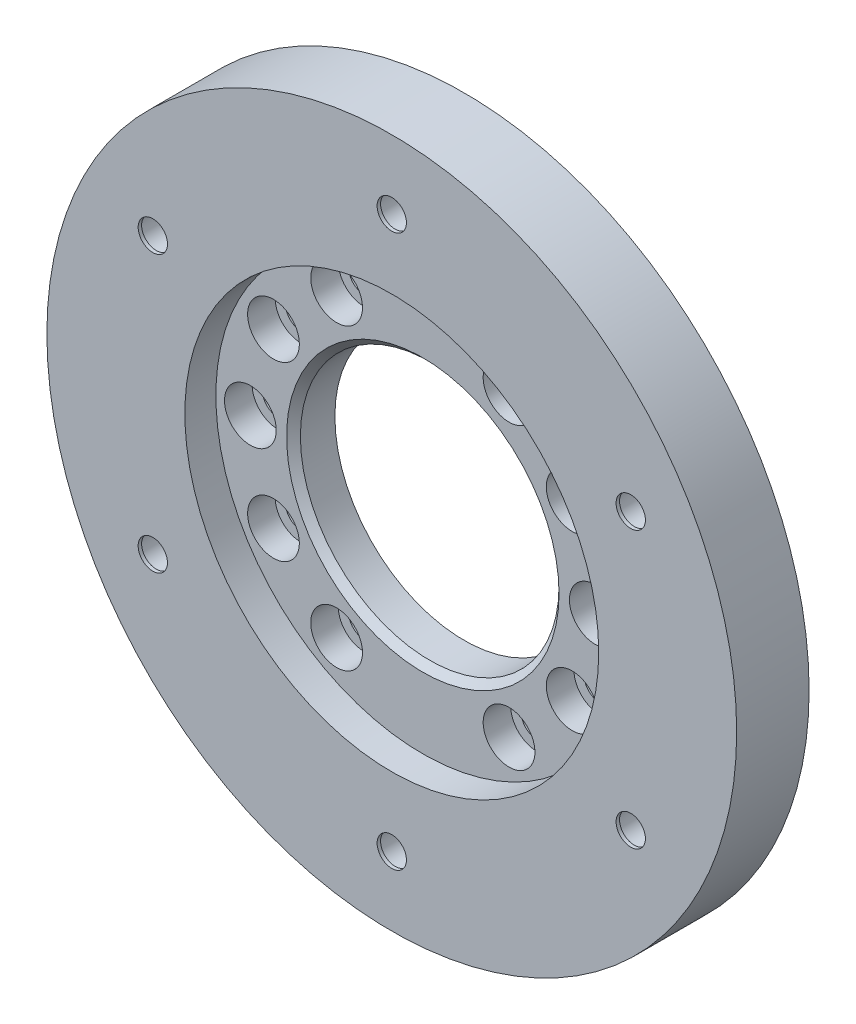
SolidWorks part; units mm, degrees
ref_plane "Plan de face" through (0, 0, 0) normal (0, 0, 1) x (1, 0, 0)
ref_plane "Plan de dessus" through (0, 0, 0) normal (0, 1, 0) x (1, 0, 0)
ref_plane "Plan de droite" through (0, 0, 0) normal (1, 0, 0) x (0, 0, -1)
sketch "Esquisse1" plane through (0, 0, 0) normal (0, 0, 1) x (1, 0, 0)
  circle A0 centre (0, 0) radius 100
  dimension "D1" = 200
extrude "Extrusion1" add sketch "Esquisse1" along normal blind 21
hole_wizard "Trou taraudé M101" positions "Esquisse3D6" profile "Esquisse9" tap size "M10" standard "ISO"
sketch3d "Esquisse3D6"
  circle A1 centre (0, 0, 0) radius 100 construction
  point P0 (0, 80, 0)
  point P9 (0, 0, 100)
  dimension "D1" = 80
sketch "Esquisse9" plane through (0, 80, 0) normal (1, 0, 0) x (0, 1, 0)
  line L0 (0, 0) -> (0, 27.0537)
  line L1 (0, 27.0537) -> (4.25, 24.5)
  line L2 (4.25, 24.5) -> (4.25, 20)
  line L3 (4.25, 20) -> (5, 20)
  line L4 (5, 20) -> (5, 0)
  line L5 (5, 0) -> (0, 0)
  line L10 (0, 27.0537) -> (-4.25, 24.5) construction
  line L11 (0, -6.35) -> (0, 107.95) construction
  dimension "Diamètre du trou pour taraudage" = 8.5
  dimension "Profondeur du trou pour taraudage" = 24.5
  dimension "Diamètre principal du filetage" = 10
  dimension "Profondeur du filetage" = 20
  dimension "Angle de pointe" = 118
sketch "Esquisse10" plane through (0, 0, 0) normal (0, 0, -1) x (-1, 0, 0)
  point P0 (0, 0)
ref_axis "Axe1" through (0, 0, 43.953) along (0, 0, -1)
pattern_circular "Répétition circulaire5" count 6 over 360 about axis through (0, 0, 0) along (0, 0, 1) of "Trou taraudé M101"
sketch "Esquisse13" plane through (0, 0, 21) normal (0, 0, 1) x (1, 0, 0)
  circle A0 centre (0, 0) radius 60
  dimension "D1" = 120
extrude "Extrusion3" cut sketch "Esquisse13" against normal blind 9
sketch "Esquisse15" plane through (0, 0, 12) normal (0, 0, 1) x (1, 0, 0)
  point P0 (-50, 0)
  point P1 (50, 0)
  dimension "D1" = 50
  dimension "D2" = 50
hole_wizard "Chambrage pour vis à tête hexagonale M81" positions "Esquisse3D9" profile "Esquisse16" counterbore size "M8" standard "ISO"
sketch3d "Esquisse3D9"
  point P0 (-50, 0, 12)
sketch "Esquisse16" plane through (-50, 0, 12) normal (1, 0, 0) x (0, -1, 0)
  line L0 (0, 0) -> (0, 12)
  line L1 (0, 12) -> (4.5, 12)
  line L3 (4.5, 12) -> (4.5, 8)
  line L4 (4.5, 8) -> (7.5, 8)
  line L5 (7.5, 8) -> (7.5, 0)
  line L7 (7.5, 0) -> (0, 0)
  line L11 (0, -6.35) -> (0, 107.95) construction
  dimension "Diamètre du perçage jusqu'au prochain" = 9
  dimension "Profondeur du perçage jusqu'au prochain" = 12
  dimension "Diamètre du chambrage" = 15
  dimension "Profondeur du chambrage" = 8
pattern_circular "Répétition circulaire6" count 3 over 60 about axis through (0, 0, 0) along (0, 0, 1) of "Chambrage pour vis à tête hexagonale M81"
pattern_circular "Répétition circulaire7" count 3 over 60 about axis through (0, 0, 0) along (0, 0, 1) of "Chambrage pour vis à tête hexagonale M81"
hole_wizard "Chambrage pour vis à tête hexagonale M82" positions "Esquisse3D10" profile "Esquisse17" counterbore size "M8" standard "ISO"
sketch3d "Esquisse3D10"
  point P0 (50, 0, 12)
sketch "Esquisse17" plane through (50, 0, 12) normal (1, 0, 0) x (0, -1, 0)
  line L0 (0, 0) -> (0, 12)
  line L1 (0, 12) -> (4.5, 12)
  line L3 (4.5, 12) -> (4.5, 8)
  line L4 (4.5, 8) -> (7.5, 8)
  line L5 (7.5, 8) -> (7.5, 0)
  line L7 (7.5, 0) -> (0, 0)
  line L11 (0, -6.35) -> (0, 107.95) construction
  dimension "Diamètre du perçage jusqu'au prochain" = 9
  dimension "Profondeur du perçage jusqu'au prochain" = 12
  dimension "Diamètre du chambrage" = 15
  dimension "Profondeur du chambrage" = 8
pattern_circular "Répétition circulaire8" count 3 over 60 about axis through (0, 0, 0) along (0, 0, 1) of "Chambrage pour vis à tête hexagonale M82"
pattern_circular "Répétition circulaire9" count 3 over 60 about axis through (0, 0, 0) along (0, 0, 1) of "Chambrage pour vis à tête hexagonale M82"
sketch "Esquisse19" plane through (0, 0, 12) normal (0, 0, 1) x (1, 0, 0)
  circle A0 centre (0, 0) radius 37.5
  dimension "D1" = 75
extrude "Extrusion4" cut sketch "Esquisse19" against normal up to next
chamfer "Chanfrein1" distance 2 angle 45 1 edges at (37.5, 0, 12)
